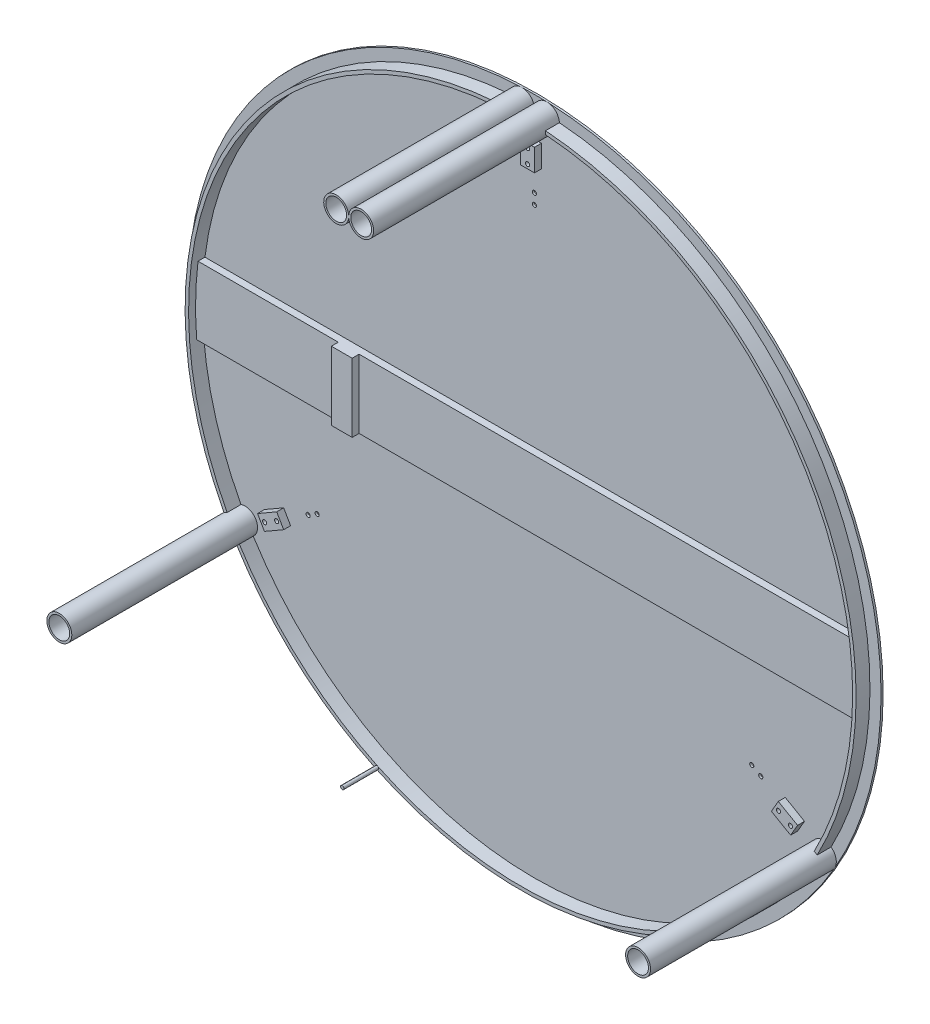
SolidWorks part; units mm, degrees
ref_plane "Plan de face" through (0, 0, 0) normal (0, 0, 1) x (1, 0, 0)
ref_plane "Plan de dessus" through (0, 0, 0) normal (0, 1, 0) x (1, 0, 0)
ref_plane "Plan de droite" through (0, 0, 0) normal (1, 0, 0) x (0, 0, -1)
sketch "Esquisse1" plane through (0, 0, 0) normal (0, 0, 1) x (1, 0, 0)
  circle A0 centre (0, 0) radius 500
  dimension "D1" = 1000
extrude "Extrusion6" add sketch "Esquisse1" along normal blind 3
sketch "Esquisse5" plane through (0, 0, 3) normal (0, 0, 1) x (1, 0, 0)
  line L0 (0, 545.1852) -> (0, 0) construction
  line L1 (0, 0) -> (-494.6084, -285.5623) construction
  line L4 (0, 0) -> (532.6805, -307.5433) construction
  arc A0 (-409.9075, -257.3554) -> (409.9075, -257.3554) centre (0, 0) ccw
  arc A1 (-405.6982, -254.6565) -> (405.6982, -254.6565) centre (0, 0) ccw
  arc A2 (-423.3881, -224.0167) -> (-427.8301, -226.3126) centre (-417.4242, -241) ccw
  arc A3 (405.6982, -254.6565) -> (409.9075, -257.3554) centre (417.4242, -241) ccw
  arc A4 (-0.1982, 479) -> (-0.1522, 484) centre (-18, 481.6638) ccw
  arc A5 (0.1522, 484) -> (0.1982, 479) centre (18, 481.6638) ccw
  circle A6 centre (0, 0) radius 500 construction
  arc A7 (-409.9075, -257.3554) -> (-405.6982, -254.6565) centre (-417.4242, -241) ccw
  arc A8 (427.8301, -226.3126) -> (35.9723, 482.6614) centre (0, 0) ccw
  arc A9 (423.3881, -224.0167) -> (35.5533, 477.6787) centre (0, 0) ccw
  arc A10 (427.8301, -226.3126) -> (423.3881, -224.0167) centre (417.4242, -241) ccw
  arc A11 (-35.5533, 477.6787) -> (-423.3881, -224.0167) centre (0, 0) ccw
  arc A12 (-35.9723, 482.6614) -> (-427.8301, -226.3126) centre (0, 0) ccw
  arc A13 (-35.9723, 482.6614) -> (-35.5533, 477.6787) centre (-18, 481.6638) ccw
  arc A14 (0.1522, 484) -> (-0.1522, 484) centre (0, 0) ccw
  arc A15 (0.1982, 479) -> (-0.1982, 479) centre (0, 0) ccw
  arc A16 (35.5533, 477.6787) -> (35.9723, 482.6614) centre (18, 481.6638) ccw
  dimension "D3" = 968
  dimension "D4" = 958
  dimension "D5" = 36
  dimension "D6" = 36
  dimension "D7" = 36
  dimension "D8" = 36
  dimension "D1" = 120
  dimension "D2" = 120
extrude "Extrusion7" add sketch "Esquisse5" along normal blind 20 contours A1 A3 A0 A7 | A11 A2 A12 A13 | A9 A16 A8 A10
sketch "Esquisse6" plane through (0, 0, 3) normal (0, 0, 1) x (1, 0, 0)
  line L0 (0, 631.4268) -> (0, 0) construction
  line L1 (0, 0) -> (-525.2859, -303.2739) construction
  line L2 (0, 0) -> (516.4842, -298.1923) construction
  circle A0 centre (-417.4242, -241) radius 18
  circle A1 centre (417.4242, -241) radius 18
  circle A2 centre (-18, 481.6638) radius 18
  circle A3 centre (18, 481.6638) radius 18
  circle A4 centre (0, 0) radius 500 construction
  dimension "D3" = 36
  dimension "D4" = 36
  dimension "D5" = 36
  dimension "D6" = 36
  dimension "D1" = 120
  dimension "D2" = 120
extrude "Extrusion10" add sketch "Esquisse6" along normal blind 268
sketch "Esquisse7" plane through (0, 0, 271) normal (0, 0, 1) x (1, 0, 0)
  circle A0 centre (-417.4242, -241) radius 18
  circle A1 centre (417.4242, -241) radius 18
  circle A2 centre (-18, 481.6638) radius 18
  circle A3 centre (18, 481.6638) radius 18
  arc A4 (-35.5533, 477.6787) -> (-423.3881, -224.0167) centre (0, 0) ccw
  arc A5 (0.1982, 479) -> (-0.1982, 479) centre (0, 0) ccw
  arc A6 (-405.6982, -254.6565) -> (405.6982, -254.6565) centre (0, 0) ccw
  arc A7 (423.3881, -224.0167) -> (35.5533, 477.6787) centre (0, 0) ccw
extrude "Enlèv. mat.-Extru.1" cut sketch "Esquisse7" against normal blind 268
sketch "Esquisse8" plane through (0, 0, 3) normal (0, 0, 1) x (1, 0, 0)
  line L0 (0, 0) -> (0, -539.2593) construction
  line L1 (0, 0) -> (-232.2364, -486.8938) construction
  line L2 (0, 0) -> (237.107, -497.1051) construction
  line L3 (-595.3575, 0) -> (669.5101, 0) construction
  circle A0 centre (-207.2911, -434.5948) radius 2.5
  arc A1 (-409.9075, -257.3554) -> (409.9075, -257.3554) centre (0, 0) ccw construction
  circle A3 centre (207.2911, -434.5948) radius 2.5
  dimension "D3" = 5
  dimension "D4" = 5
  dimension "D1" = 64.5
  dimension "D2" = 64.5
extrude "Extrusion11" add sketch "Esquisse8" along normal blind 70
sketch "Esquisse9" plane through (0, 0, 3) normal (0, 0, 1) x (1, 0, 0)
  line L0 (0, 500) -> (-151.9937, 500) construction
  line L1 (-475.3525, 59) -> (475.3525, 59)
  line L3 (-477.3286, -39.9803) -> (477.3286, -39.9803)
  line L6 (0, -500) -> (446.5188, -500) construction
  arc A3 (18.6722, 499.6512) -> (-18.6722, 499.6512) centre (0, 0) ccw construction
  arc A4 (-433.0127, -250) -> (433.0127, -250) centre (0, 0) ccw construction
  arc A5 (477.3286, -39.9803) -> (475.3525, 59) centre (0, 0) ccw
  arc A6 (-475.3525, 59) -> (-477.3286, -39.9803) centre (0, 0) ccw
  dimension "D3" = 958
  dimension "D1" = 99
  dimension "D2" = 441
extrude "Extrusion12" add sketch "Esquisse9" along normal blind 10
sketch "Esquisse10" plane through (0, 0, 271) normal (0, 0, 1) x (1, 0, 0)
  circle A0 centre (-417.4242, -241) radius 15
  circle A1 centre (417.4242, -241) radius 15
  circle A2 centre (-18, 481.6638) radius 15
  circle A3 centre (18, 481.6638) radius 15
  dimension "D1" = 30
  dimension "D2" = 30
  dimension "D3" = 30
  dimension "D4" = 30
extrude "Enlèv. mat.-Extru.2" cut sketch "Esquisse10" against normal blind 268
sketch "Esquisse11" plane through (0, 0, 13) normal (0, 0, 1) x (1, 0, 0)
  line L0 (475.3525, 59) -> (-475.3525, 59) construction
  line L1 (-273, 59) -> (-243, 59)
  line L2 (-273, 59) -> (-273, -39.9803)
  line L3 (-273, -39.9803) -> (-243, -39.9803)
  line L4 (-243, 59) -> (-243, -39.9803)
  line L5 (-477.3286, -39.9803) -> (477.3286, -39.9803) construction
  dimension "D1" = 30
  dimension "D2" = 243
extrude "Extrusion13" add sketch "Esquisse11" along normal blind 10
sketch "Esquisse12" plane through (0, 0, 3) normal (0, 0, 1) x (1, 0, 0)
  line L0 (0, 561.4062) -> (0, 0) construction
  line L1 (10, 444) -> (-10, 444)
  line L2 (10, 444) -> (10, 412)
  line L3 (10, 412) -> (-10, 412)
  line L4 (-10, 444) -> (-10, 412)
  line L5 (0, 484) -> (-57.2681, 484) construction
  line L6 (0, 0) -> (-417.4242, -241) construction
  line L7 (0, 0) -> (417.4242, -241) construction
  line L8 (-57.2681, 484) -> (76.8224, 484) construction
  line L9 (-389.5153, -213.3397) -> (-361.8025, -197.3397)
  line L10 (-379.5153, -230.6603) -> (-351.8025, -214.6603)
  line L11 (-361.8025, -197.3397) -> (-351.8025, -214.6603)
  line L12 (-389.5153, -213.3397) -> (-379.5153, -230.6603)
  line L13 (0, 0) -> (0, 482) construction
  line L14 (0, 0) -> (417.4242, -241) construction
  line L15 (379.5153, -230.6603) -> (351.8025, -214.6603)
  line L16 (389.5153, -213.3397) -> (361.8025, -197.3397)
  line L17 (351.8025, -214.6603) -> (361.8025, -197.3397)
  line L18 (379.5153, -230.6603) -> (389.5153, -213.3397)
  line L19 (0, 0) -> (0, 482) construction
  dimension "D4" = 412
  dimension "D1" = 32
  dimension "D2" = 10
  dimension "D3" = 10
  dimension "D5" = 40
  dimension "D6" = 10
  dimension "D7" = 38
  dimension "D8" = 10
  dimension "D9" = 38
extrude "Extrusion14" add sketch "Esquisse12" along normal blind 10
sketch "Esquisse13" plane through (0, 0, 13) normal (0, 0, 1) x (1, 0, 0)
  line L0 (-10, 412) -> (10, 412) construction
  line L1 (-10, 444) -> (-10, 412) construction
  line L2 (-351.8025, -214.6603) -> (-361.8025, -197.3397) construction
  line L3 (-379.5153, -230.6603) -> (-351.8025, -214.6603) construction
  line L4 (389.5153, -213.3397) -> (361.8025, -197.3397) construction
  line L5 (361.8025, -197.3397) -> (351.8025, -214.6603) construction
  circle A0 centre (0, 438) radius 3
  circle A1 centre (0, 418) radius 3
  circle A2 centre (-361.9986, -209) radius 3
  circle A3 centre (-379.3191, -219) radius 3
  circle A4 centre (361.9986, -209) radius 3
  circle A5 centre (379.3191, -219) radius 3
  dimension "D1" = 6
  dimension "D2" = 6
  dimension "D3" = 20
  dimension "D4" = 6
  dimension "D5" = 10
  dimension "D6" = 10
  dimension "D7" = 6
  dimension "D8" = 6
  dimension "D9" = 6
  dimension "D10" = 20
  dimension "D11" = 10
  dimension "D13" = 10
  dimension "D14" = 10
  dimension "D15" = 20
  dimension "D16" = 6
  dimension "D17" = 6
  dimension "D18" = 6
  dimension "D12" = 10
extrude "Enlèv. mat.-Extru.3" cut sketch "Esquisse13" against normal blind 10
sketch "Esquisse14" plane through (0, 0, 3) normal (0, 0, 1) x (1, 0, 0)
  line L0 (-351.8025, -214.6603) -> (-361.8025, -197.3397) construction
  line L1 (-379.5153, -230.6603) -> (-351.8025, -214.6603) construction
  line L2 (361.8025, -197.3397) -> (351.8025, -214.6603) construction
  line L3 (389.5153, -213.3397) -> (361.8025, -197.3397) construction
  line L4 (351.8025, -214.6603) -> (379.5153, -230.6603) construction
  line L5 (-10, 412) -> (10, 412) construction
  line L6 (-10, 444) -> (-10, 412) construction
  line L7 (10, 412) -> (10, 444) construction
  circle A0 centre (-326.4916, -188.5) radius 3
  circle A1 centre (-313.5012, -181) radius 3
  circle A2 centre (326.4916, -188.5) radius 3
  circle A3 centre (313.5012, -181) radius 3
  circle A4 centre (0, 377) radius 3
  circle A5 centre (0, 362) radius 3
  point P25 (-10, 428)
  dimension "D1" = 6
  dimension "D2" = 6
  dimension "D3" = 15
  dimension "D4" = 35
  dimension "D6" = 10
  dimension "D7" = 6
  dimension "D8" = 6
  dimension "D9" = 15
  dimension "D10" = 35
  dimension "D11" = 10
  dimension "D12" = 10
  dimension "D13" = 6
  dimension "D14" = 6
  dimension "D15" = 35
  dimension "D16" = 15
  dimension "D17" = 10
  dimension "D18" = 10
  dimension "D5" = 10
extrude "Enlèv. mat.-Extru.4" cut sketch "Esquisse14" against normal through all
sketch "Esquisse15" plane through (0, 0, 3) normal (0, 0, 1) x (1, 0, 0)
  circle A0 centre (-417.4242, -241) radius 5
  circle A1 centre (417.4242, -241) radius 5
  circle A2 centre (-18, 481.6638) radius 5
  circle A3 centre (18, 481.6638) radius 5
  dimension "D1" = 10
  dimension "D2" = 10
  dimension "D3" = 10
  dimension "D4" = 10
extrude "Enlèv. mat.-Extru.5" cut sketch "Esquisse15" against normal through all
